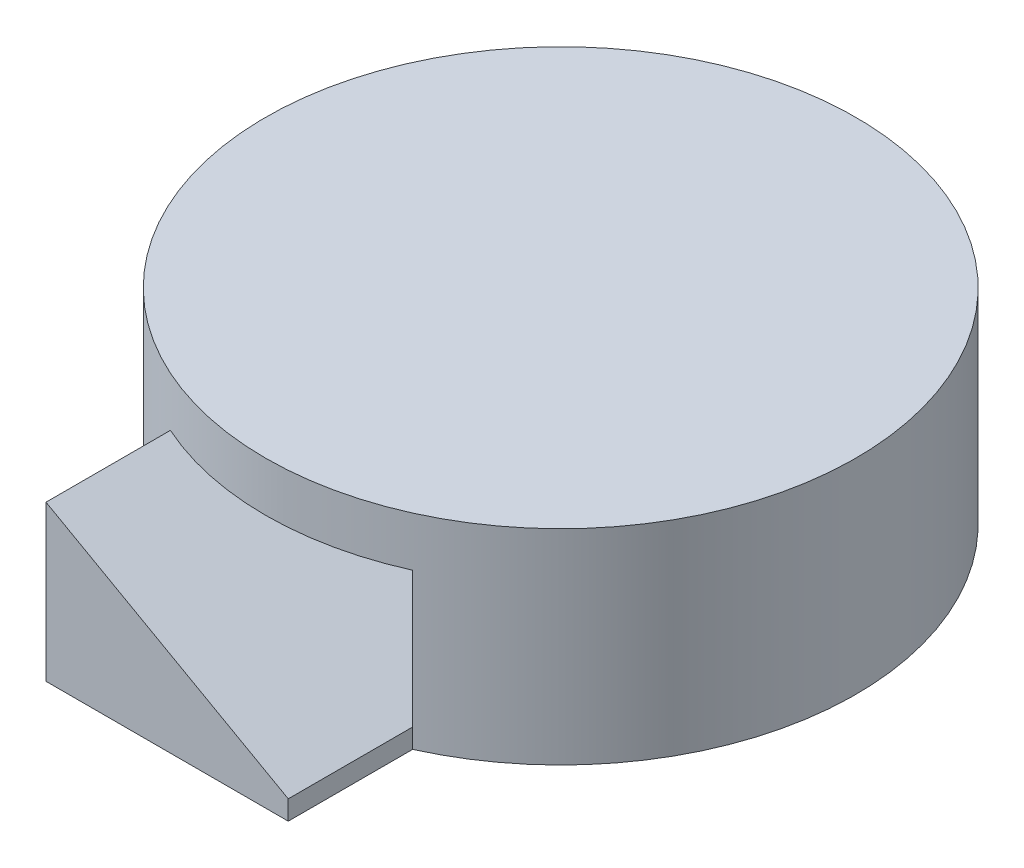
SolidWorks part; units mm, degrees
ref_plane "Front" through (0, 0, 0) normal (0, 0, 1) x (1, 0, 0)
ref_plane "Top" through (0, 0, 0) normal (0, 1, 0) x (1, 0, 0)
ref_plane "Right" through (0, 0, 0) normal (1, 0, 0) x (0, 0, -1)
sketch "Sketch1" plane through (0, 0, 0) normal (0, 1, 0) x (1, 0, 0)
  circle A0 centre (0, 0) radius 75
  dimension "D1" = 150
extrude "Extrude1" add sketch "Sketch1" along normal blind 52
ref_plane "Plane2" through (0, 0, 100) normal (0, 0, 1) x (1, 0, 0)
sketch "Sketch3" plane through (0, 0, 100) normal (0, 0, 1) x (1, 0, 0)
  line L1 (-30.7751, 39.4246) -> (30.7751, 39.4246)
  line L2 (-30.7751, 39.4246) -> (-30.7751, 0)
  line L3 (-30.7751, 0) -> (30.7751, 0)
  line L4 (30.7751, 39.4246) -> (30.7751, 0)
extrude "Extrude2" add sketch "Sketch3" against normal up to surface
sketch "Sketch4" plane through (0, 0, 100) normal (0, 0, 1) x (1, 0, 0)
  line L0 (-30.7751, 39.4246) -> (30.7751, 4.9271)
  line L2 (30.7751, 4.9271) -> (30.7751, 39.4246)
  line L3 (30.7751, 39.4246) -> (-30.7751, 39.4246)
extrude "Cut-Extrude2" cut sketch "Sketch4" against normal up to next
